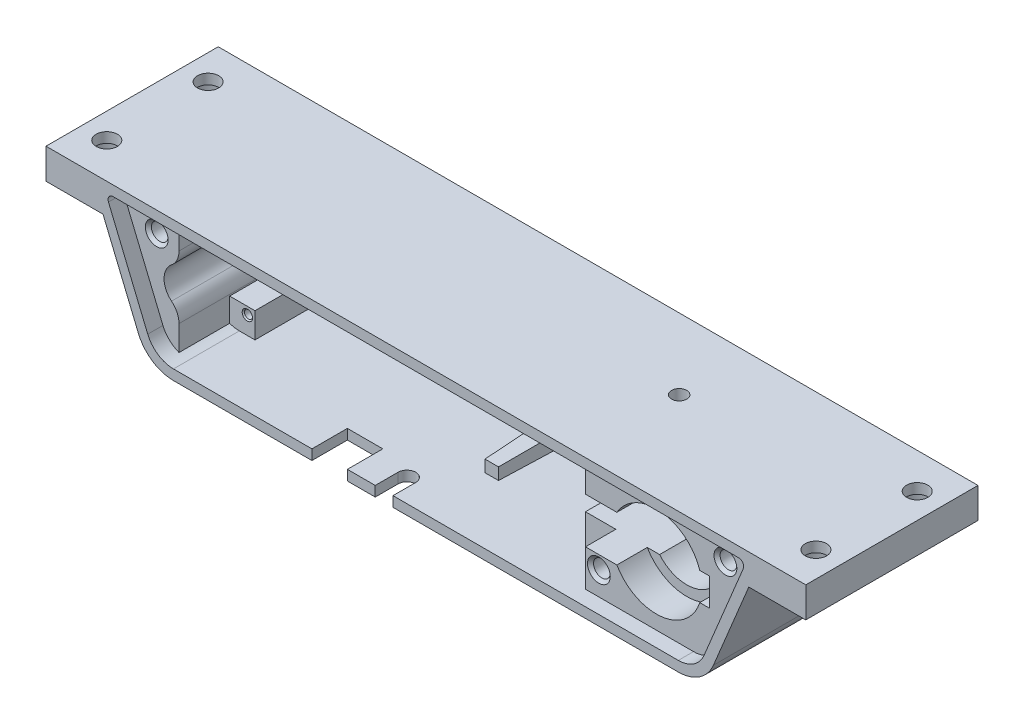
SolidWorks part; units mm, degrees
ref_plane "Front" through (0, 0, 0) normal (0, 0, 1) x (1, 0, 0)
ref_plane "Top" through (0, 0, 0) normal (0, 1, 0) x (1, 0, 0)
ref_plane "Right" through (0, 0, 0) normal (1, 0, 0) x (0, 0, -1)
sketch "Esquisse1" plane through (0, 0, 0) normal (0, 0, 1) x (1, 0, 0)
  line L0 (-75, 0) -> (75, 0)
  line L1 (75, 0) -> (75, -6)
  line L2 (75, -6) -> (63.75, -6)
  line L3 (63.75, -6) -> (56.7622, -22.8701)
  line L4 (49.8331, -27.5) -> (-49.8331, -27.5)
  line L5 (0, 0) -> (0, -27.5) construction
  line L6 (-63.75, -6) -> (-56.7622, -22.8701)
  line L7 (-75, -6) -> (-63.75, -6)
  line L8 (-75, 0) -> (-75, -6)
  arc A0 (49.8331, -27.5) -> (56.7622, -22.8701) centre (49.8331, -20) ccw
  arc A1 (-49.8331, -27.5) -> (-56.7622, -22.8701) centre (-49.8331, -20) cw
  dimension "D2" = 15
  dimension "D3" = 6
  dimension "D1" = 75
  dimension "D4" = 67.5
  dimension "D5" = 63.75
  dimension "D6" = 27.5
extrude "Boss.-Extru.1" add sketch "Esquisse1" along normal blind 34
sketch "Esquisse2" plane through (0, 0, 34) normal (0, 0, 1) x (1, 0, 0)
  line L13 (75, -2) -> (-75, -2)
  line L14 (-61.9022, -5.2346) -> (-54.9144, -22.1048)
  line L15 (-49.8331, -25.5) -> (49.8331, -25.5)
  line L16 (54.9144, -22.1048) -> (61.9022, -5.2346)
  line L17 (-63.2421, -2) -> (-54.9144, -22.1048)
  line L18 (-49.8331, -25.5) -> (49.8331, -25.5)
  line L19 (54.9144, -22.1048) -> (63.2421, -2)
  line L20 (63.2421, -2) -> (-63.2421, -2)
  arc A7 (-54.9144, -22.1048) -> (-49.8331, -25.5) centre (-49.8331, -20) ccw
  arc A8 (49.8331, -25.5) -> (54.9144, -22.1048) centre (49.8331, -20) ccw
  arc A9 (-54.9144, -22.1048) -> (-49.8331, -25.5) centre (-49.8331, -20) ccw
  arc A10 (49.8331, -25.5) -> (54.9144, -22.1048) centre (49.8331, -20) ccw
  dimension "D1" = 2
  dimension "D2" = 2
extrude "Enlèv. mat.-Extru.1" cut sketch "Esquisse2" against normal offset from surface (32 mm away) 2
sketch "Esquisse3" plane through (0, 0, 2) normal (0, 0, 1) x (1, 0, 0)
  line L0 (0, 0) -> (0, -27.5) construction
  line L1 (-49.8331, -27.5) -> (49.8331, -27.5) construction
  line L2 (-63.2421, -2) -> (63.2421, -2) construction
  line L3 (-2, -2) -> (2, -2)
  line L4 (-2, -2) -> (-2, -5)
  line L5 (-2, -5) -> (2, -5)
  line L6 (2, -2) -> (2, -5)
  line L7 (-2, -2) -> (2, -5) construction
  line L8 (-2, -5) -> (2, -2) construction
  line L9 (0, -13.75) -> (58.3751, -13.75) construction
  line L10 (63.2421, -2) -> (54.9144, -22.1048) construction
  line L11 (-2, -22.5) -> (2, -25.5) construction
  line L12 (-2, -25.5) -> (2, -22.5) construction
  line L13 (2, -25.5) -> (2, -22.5)
  line L14 (-2, -22.5) -> (2, -22.5)
  line L15 (-2, -25.5) -> (-2, -22.5)
  line L16 (-2, -25.5) -> (2, -25.5)
  point P5 (0, -3.5)
  point P20 (0, -24)
  dimension "D1" = 4
  dimension "D2" = 3
extrude "Boss.-Extru.2" add sketch "Esquisse3" along normal blind 19
draft "Dépouille1" type of draft neutral plane draft angle 2 faces to draft 6 parameters "D1"=2
sketch "Esquisse4" plane through (0, 0, 2) normal (0, 0, 1) x (1, 0, 0)
  line L0 (0, 0) -> (0, -27.5) construction
  line L1 (-49.8331, -27.5) -> (49.8331, -27.5) construction
  line L2 (22.5, -2) -> (22.5, -9.25)
  line L3 (63.2421, -2) -> (-63.2421, -2) construction
  line L4 (22.5, -9.25) -> (37.1381, -9.25)
  line L5 (0, -13.75) -> (58.3751, -13.75) construction
  line L6 (54.9144, -22.1048) -> (63.2421, -2) construction
  line L7 (48.9372, -11) -> (53, -11)
  line L8 (53, -11) -> (53, -16.5)
  line L9 (48.9372, -16.5) -> (53, -16.5)
  line L10 (22.5, -18.25) -> (37.1381, -18.25)
  line L11 (22.5, -25.5) -> (22.5, -18.25)
  line L12 (63.2421, -2) -> (22.5, -2)
  line L13 (54.9144, -22.1048) -> (63.2421, -2)
  line L14 (49.8331, -25.5) -> (2, -25.5) construction
  line L15 (49.8331, -25.5) -> (22.5, -25.5)
  arc A0 (37.1381, -18.25) -> (48.9372, -16.5) centre (42.5, -13.75) ccw
  arc A1 (48.9372, -11) -> (37.1381, -9.25) centre (42.5, -13.75) ccw
  arc A2 (49.8331, -25.5) -> (54.9144, -22.1048) centre (49.8331, -20) ccw construction
  arc A3 (49.8331, -25.5) -> (54.9144, -22.1048) centre (49.8331, -20) ccw
  point P20 (53, -13.75)
  dimension "D1" = 14
  dimension "D2" = 42.5
  dimension "D3" = 4.5
  dimension "D4" = 22.5
  dimension "D5" = 2.75
  dimension "D6" = 10.5
extrude "Boss.-Extru.3" add sketch "Esquisse4" along normal blind 23
sketch "Esquisse5" plane through (0, 0, 25) normal (0, 0, 1) x (1, 0, 0)
  line L0 (28.5, -2) -> (28.5, -9.25)
  line L1 (63.2421, -2) -> (-63.2421, -2) construction
  line L2 (22.5, -2) -> (22.5, -9.25) construction
  line L3 (22.5, -9.25) -> (37.1381, -9.25) construction
  line L4 (28.5, -9.25) -> (34.7058, -9.25)
  line L5 (42.5, -13.75) -> (58.3751, -13.75) construction
  line L6 (54.9144, -22.1048) -> (63.2421, -2) construction
  line L7 (28.5, -18.25) -> (34.7058, -18.25)
  line L8 (28.5, -25.5) -> (28.5, -18.25)
  line L9 (63.2421, -2) -> (22.5, -2) construction
  line L10 (63.2421, -2) -> (28.5, -2)
  line L11 (54.9144, -22.1048) -> (63.2421, -2) construction
  line L12 (54.9144, -22.1048) -> (63.2421, -2)
  line L13 (48.9372, -11) -> (53, -11) construction
  line L14 (51.0696, -11) -> (53, -11)
  line L15 (53, -11) -> (53, -16.5) construction
  line L16 (53, -11) -> (53, -16.5)
  line L17 (53, -16.5) -> (48.9372, -16.5) construction
  line L18 (53, -16.5) -> (51.0696, -16.5)
  line L19 (22.5, -25.5) -> (49.8331, -25.5) construction
  line L20 (28.5, -25.5) -> (49.8331, -25.5)
  arc A0 (34.7058, -18.25) -> (51.0696, -16.5) centre (42.5, -13.75) ccw
  arc A1 (51.0696, -11) -> (34.7058, -9.25) centre (42.5, -13.75) ccw
  arc A2 (49.8331, -25.5) -> (54.9144, -22.1048) centre (49.8331, -20) ccw construction
  arc A3 (49.8331, -25.5) -> (54.9144, -22.1048) centre (49.8331, -20) ccw
  dimension "D1" = 18
  dimension "D2" = 6
extrude "Boss.-Extru.4" add sketch "Esquisse5" along normal blind 6
sketch "Esquisse6" plane through (0, 0, 2) normal (0, 0, 1) x (1, 0, 0)
  line L0 (-51.7421, -2) -> (-51.7421, -10.1395)
  line L1 (-63.2421, -2) -> (-2, -2) construction
  line L3 (-60.4363, -14) -> (-43.1436, -14) construction
  line L4 (-63.75, -6) -> (-56.7622, -22.8701) construction
  line L5 (75, 0) -> (-75, 0) construction
  line L7 (-51.7421, -17.8605) -> (-51.7421, -25.1581)
  line L8 (-59.1306, -4.0866) -> (-52.1428, -20.9567)
  line L9 (-59.9949, -2) -> (-51.7421, -21.9241) construction
  line L10 (-54.9144, -22.1048) -> (-63.2421, -2) construction
  line L11 (-54.9144, -22.1048) -> (-63.2421, -2)
  line L12 (-63.2421, -2) -> (-51.7421, -2)
  arc A0 (-54.9144, -22.1048) -> (-49.8331, -25.5) centre (-49.8331, -20) ccw construction
  arc A1 (-51.7421, -10.1395) -> (-51.7421, -17.8605) centre (-50.6948, -14) ccw
  arc A2 (-54.9144, -22.1048) -> (-49.8331, -25.5) centre (-49.8331, -20) ccw construction
  arc A3 (-54.9144, -22.1048) -> (-51.7421, -25.1581) centre (-49.8331, -20) ccw
  dimension "D4" = 8
  dimension "D1" = 11.5
  dimension "D2" = 14
  dimension "D3" = 5
extrude "Boss.-Extru.5" add sketch "Esquisse6" along normal up to surface (29 mm away)
fillet "Congé1" radius 4 2 edges at (-51.7421, -17.8605, 16.5) (-51.7421, -10.1395, 16.5)
sketch "Esquisse7" plane through (0, 0, 2) normal (0, 0, 1) x (1, 0, 0)
  line L0 (-51.7421, -2) -> (-46.7421, -2)
  line L1 (63.2421, -2) -> (-63.2421, -2) construction
  line L2 (-46.7421, -2) -> (-46.7421, -7)
  line L3 (-46.7421, -7) -> (-51.7421, -7)
  line L4 (-51.7421, -7.7932) -> (-51.7421, -2) construction
  line L5 (-51.7421, -7) -> (-51.7421, -2)
  line L6 (53, -13.75) -> (60.5398, -13.75) construction
  line L7 (53, -11) -> (53, -16.5) construction
  line L8 (56.7622, -22.8701) -> (63.75, -6) construction
  dimension "D1" = 5
  dimension "D2" = 5
extrude "Boss.-Extru.6" add sketch "Esquisse7" along normal up to surface (23 mm away)
sketch "Esquisse23" plane through (0, 0, 2) normal (0, 0, 1) x (1, 0, 0)
  line L0 (-51.7421, -20.5) -> (-46.7421, -20.5)
  line L1 (-51.7421, -25.1581) -> (-51.7421, -20.2068) construction
  line L2 (-46.7421, -20.5) -> (-46.7421, -25.5)
  line L3 (-49.8331, -25.5) -> (49.8331, -25.5) construction
  line L4 (-2, -25.5) -> (-49.8331, -25.5) construction
  line L5 (-51.7421, -25.1581) -> (-51.7421, -20.5)
  line L6 (-49.8331, -25.5) -> (-46.7421, -25.5)
  arc A0 (-54.9144, -22.1048) -> (-49.8331, -25.5) centre (-49.8331, -20) ccw construction
  arc A1 (-51.7421, -25.1581) -> (-49.8331, -25.5) centre (-49.8331, -20) ccw
  dimension "D1" = 5
  dimension "D2" = 5
extrude "Boss.-Extru.7" add sketch "Esquisse23" along normal blind 19
sketch "Esquisse8" plane through (0, 0, 31) normal (0, 0, 1) x (1, 0, 0)
  line L2 (-58.946, -0.2205) -> (-50.6184, -20.3253)
  line L3 (-58.946, -0.2205) -> (-47.6465, -27.5) construction
  line L4 (-49.8331, -27.5) -> (49.8331, -27.5) construction
  line L5 (-63.3358, -7) -> (-51.8215, -7) construction
  line L6 (-63.75, -6) -> (-56.7622, -22.8701) construction
  line L7 (75, 0) -> (-75, 0) construction
  line L8 (0, 0) -> (0, -27.5) construction
  line L9 (63.3358, -7) -> (51.8215, -7) construction
  line L10 (58.946, -0.2205) -> (47.6465, -27.5) construction
  line L13 (31.15, -18.25) -> (31.15, -25.5) construction
  line L14 (37.1381, -18.25) -> (22.5, -18.25) construction
  line L15 (28.5, -25.5) -> (49.8331, -25.5) construction
  line L16 (28.5, -18.25) -> (28.5, -25.5) construction
  line L17 (28.5, -20.9) -> (31.15, -20.9) construction
  line L18 (28.5, -18.25) -> (28.5, -25.5) construction
  arc A0 (-53.2184, -10.8966) -> (-51.7421, -7.7932) centre (-55.7421, -7.7932) ccw construction
  arc A1 (-53.2184, -10.8966) -> (-51.7421, -7.7932) centre (-55.7421, -7.7932) ccw construction
  point P14 (-56.1379, -7)
  point P21 (56.1379, -7)
  dimension "D2" = 7
  dimension "D3" = 2.65
  dimension "D4" = 2.65
  dimension "D1" = 4.65
hole_wizard "Trou taraudé M41" positions "Esquisse9" profile "Esquisse10" tap size "M4" standard "ISO"
sketch "Esquisse9" plane through (0, 0, 31) normal (0, 0, 1) x (1, 0, 0)
  point P0 (-56.1379, -7)
  point P3 (31.15, -20.9)
  point P6 (56.1379, -7)
sketch "Esquisse10" plane through (-56.1379, -7, 31) normal (1, 0, 0) x (0, -1, 0)
  line L0 (0, 0) -> (0, 8.4914)
  line L1 (0, 8.4914) -> (1.65, 7.5)
  line L2 (1.65, 7.5) -> (1.65, 0.6)
  line L3 (1.65, 0.6) -> (2.25, 0)
  line L5 (2.25, 0) -> (0, 0)
  line L6 (-1.65, 0.6) -> (-2.25, 0) construction
  line L10 (0, 8.4914) -> (-1.65, 7.5) construction
  line L11 (0, -6.35) -> (0, 107.95) construction
  dimension "Diamètre du trou pour taraudage" = 3.3
  dimension "Profondeur du trou pour taraudage" = 7.5
  dimension "Diamètre du fraisage entrant" = 4.5
  dimension "Angle du fraisage entrant" = 90
  dimension "Angle de pointe" = 118
fillet "Congé2" radius 1 2 edges at (63.2421, -2, 32.5) (-63.2421, -2, 32.5)
sketch "Esquisse11" plane through (0, 0, 34) normal (0, 0, 1) x (1, 0, 0)
  line L0 (-2, -25.5) -> (-46.7421, -25.5) construction
  line L1 (-22.5, -25.5) -> (-15.5, -25.5)
  line L2 (-22.5, -25.5) -> (-22.5, -27.5)
  line L3 (-22.5, -27.5) -> (-15.5, -27.5)
  line L4 (-15.5, -25.5) -> (-15.5, -27.5)
  line L5 (-49.8331, -27.5) -> (49.8331, -27.5) construction
  line L6 (28.5, -18.25) -> (28.5, -25.5) construction
  dimension "D1" = 7
  dimension "D2" = 44
extrude "Enlèv. mat.-Extru.2" cut sketch "Esquisse11" against normal blind 7
sketch "Esquisse12" plane through (0, -27.5, 0) normal (0, -1, 0) x (1, 0, 0)
  line L1 (-8.25, 34) -> (-8.25, 29.5) construction
  line L2 (-15.5, 34) -> (49.8331, 34) construction
  line L3 (-15.5, 27) -> (-15.5, 34) construction
  line L4 (-10, 34) -> (-10, 29.5)
  line L6 (-8.25, 29.5) -> (-10, 29.5) construction
  line L7 (-6.5, 34) -> (-6.5, 29.5)
  line L8 (-10, 34) -> (-6.5, 34)
  arc A0 (-10, 29.5) -> (-6.5, 29.5) centre (-8.25, 29.5) ccw
  dimension "D3" = 3.5
  dimension "D1" = 4.5
  dimension "D2" = 7.25
extrude "Enlèv. mat.-Extru.3" cut sketch "Esquisse12" against normal up to next
sketch "Esquisse13" plane through (0, -27.5, 0) normal (0, -1, 0) x (1, 0, 0)
  line L0 (49.8331, 14) -> (-49.8331, 14) construction
  line L1 (49.8331, 34) -> (49.8331, 0) construction
  line L2 (-49.8331, 34) -> (-49.8331, 0) construction
  line L3 (-49.8331, 0) -> (49.8331, 0) construction
  line L4 (30, 14) -> (30, 0) construction
  circle A0 centre (30, 14) radius 1.5
  dimension "D3" = 3
  dimension "D1" = 14
  dimension "D2" = 30
extrude "Enlèv. mat.-Extru.4" cut sketch "Esquisse13" against normal up to surface (27.5 mm away)
sketch "Esquisse15" plane through (0, -6, 0) normal (0, -1, 0) x (1, 0, 0)
  line L0 (-75, 17) -> (75, 17) construction
  line L1 (-75, 34) -> (-75, 0) construction
  line L2 (75, 34) -> (75, 0) construction
  line L3 (0, 0) -> (0, 34) construction
  line L4 (-6.5, 34) -> (49.8331, 34) construction
  line L5 (-70, 34) -> (-70, 0) construction
  line L6 (-75, 34) -> (-63.75, 34) construction
  line L7 (-75, 0) -> (-63.75, 0) construction
  line L8 (70, 34) -> (70, 0) construction
  point P17 (-70, 27)
  point P19 (-70, 7)
  point P20 (70, 7)
  point P21 (70, 27)
  dimension "D1" = 70
  dimension "D2" = 10
hole_wizard "Chambrage pour vis à tête hexagonale M41" positions "Esquisse18" profile "Esquisse19" counterbore size "M4" standard "ISO"
sketch "Esquisse18" plane through (0, -6, 0) normal (0, -1, 0) x (-1, 0, 0)
  point P0 (70, -27)
  point P3 (70, -7)
  point P6 (-70, -27)
  point P9 (-70, -7)
sketch "Esquisse19" plane through (-70, -6, 27) normal (1, 0, 0) x (0, 0, -1)
  line L0 (0, 0) -> (0, 6)
  line L1 (0, 6) -> (2.1, 6)
  line L3 (2.1, 6) -> (2.1, 4)
  line L4 (2.1, 4) -> (4.25, 4)
  line L5 (4.25, 4) -> (4.25, 0)
  line L7 (4.25, 0) -> (0, 0)
  line L11 (0, -6.35) -> (0, 107.95) construction
  dimension "Diamètre du perçage jusqu'au prochain" = 4.2
  dimension "Profondeur du perçage jusqu'au prochain" = 6
  dimension "Diamètre du chambrage" = 8.5
  dimension "Profondeur du chambrage" = 4
ref_plane "Plan1" through (0, -13.75, 0) normal (0, 1, 0) x (1, 0, 0)
sketch "Esquisse20" plane through (0, 0, 21) normal (0, 0, 1) x (1, 0, 0)
  line L0 (-48.2421, -20.5) -> (-48.2421, -22) construction
  line L2 (-48.2421, -22) -> (-46.7421, -22) construction
  line L4 (-46.7421, -25.5) -> (-46.7421, -20.5) construction
  line L5 (-46.7421, -20.5) -> (-51.7421, -20.5) construction
  dimension "D1" = 1.5
  dimension "D2" = 1.5
hole_wizard "Trou taraudé M21" positions "Esquisse21" profile "Esquisse22" tap size "M2" standard "ISO"
sketch "Esquisse21" plane through (0, 0, 21) normal (0, 0, 1) x (1, 0, 0)
  point P0 (-48.2421, -22)
sketch "Esquisse22" plane through (-48.2421, -22, 21) normal (1, 0, 0) x (0, -1, 0)
  line L0 (0, 0) -> (0, 6.4807)
  line L1 (0, 6.4807) -> (0.8, 6)
  line L2 (0.8, 6) -> (0.8, 0.225)
  line L3 (0.8, 0.225) -> (1.025, 0)
  line L5 (1.025, 0) -> (0, 0)
  line L6 (-0.8, 0.225) -> (-1.025, 0) construction
  line L10 (0, 6.4807) -> (-0.8, 6) construction
  line L11 (0, -6.35) -> (0, 107.95) construction
  dimension "Diamètre du trou pour taraudage" = 1.6
  dimension "Profondeur du trou pour taraudage" = 6
  dimension "Diamètre du fraisage entrant" = 2.05
  dimension "Angle du fraisage entrant" = 90
  dimension "Angle de pointe" = 118
sketch "Esquisse24" plane through (0, 0, 2) normal (0, 0, 1) x (1, 0, 0)
  circle A0 centre (-50.6948, -14) radius 4
  dimension "D1" = 8
extrude "Enlèv. mat.-Extru.5" cut sketch "Esquisse24" against normal up to next
